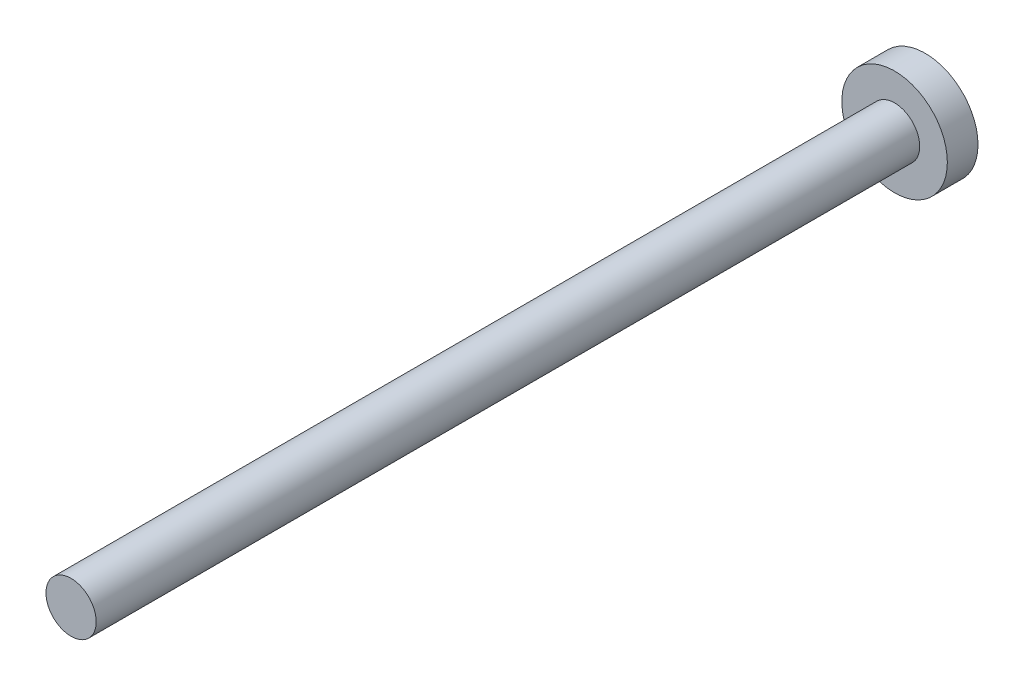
SolidWorks part; units mm, degrees
ref_plane "Face" through (0, 0, 0) normal (0, 0, 1) x (1, 0, 0)
ref_plane "Dessus" through (0, 0, 0) normal (0, 1, 0) x (1, 0, 0)
ref_plane "Droite" through (0, 0, 0) normal (1, 0, 0) x (0, 0, -1)
sketch "Esquisse1" plane through (0, 0, 0) normal (0, 0, 1) x (1, 0, 0)
  circle A0 centre (0, 0) radius 5.25
  dimension "D1" = 10.5
extrude "Extrusion1" add sketch "Esquisse1" along normal blind 3.05
sketch "Esquisse2" plane through (0, 0, 3.05) normal (0, 0, 1) x (1, 0, 0)
  circle A0 centre (0, 0) radius 2.5
  dimension "D1" = 5
extrude "Extrusion2" add sketch "Esquisse2" along normal blind 81.95
